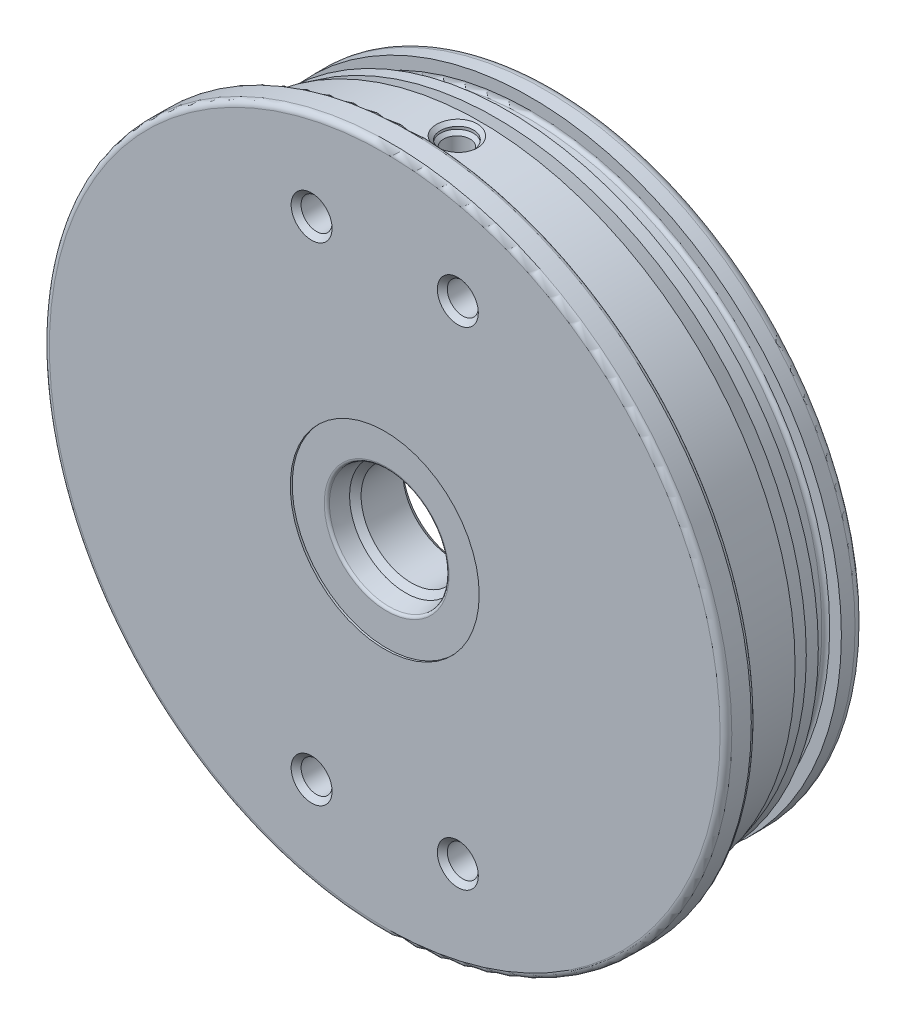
SolidWorks part; units mm, degrees
ref_plane "Front Plane" through (0, 0, 0) normal (0, 0, 1) x (1, 0, 0)
ref_plane "Top Plane" through (0, 0, 0) normal (0, 1, 0) x (1, 0, 0)
ref_plane "Right Plane" through (0, 0, 0) normal (1, 0, 0) x (0, 0, -1)
sketch "Sketch1" plane through (0, 0, 0) normal (1, 0, 0) x (0, 0, -1)
  line L0 (0, 0) -> (-31.3505, 0) construction
  line L1 (0, 0) -> (0, 39.1668)
  line L2 (-1.27, 40.4368) -> (-3.048, 40.4368)
  line L3 (-3.048, 40.4368) -> (-3.048, 38.9128)
  line L4 (-3.556, 38.4048) -> (-5.5471, 38.4048)
  line L5 (-6.0551, 38.9128) -> (-6.0551, 40.4368)
  line L6 (-6.0551, 40.4368) -> (-7.62, 40.4368)
  line L11 (-7.62, 40.4368) -> (-9.6107, 40.9702)
  line L12 (-9.6107, 40.9702) -> (-17.526, 40.9702)
  line L13 (-18.288, 41.7322) -> (-18.288, 44.45)
  line L14 (-18.288, 44.45) -> (-22.098, 44.45)
  line L15 (-22.098, 44.45) -> (-22.098, 0)
  line L16 (0, 0) -> (-22.098, 0)
  line L17 (-17.399, 41.1226) -> (-9.7523, 41.1226) construction
  arc A0 (-17.526, 40.9702) -> (-18.288, 41.7322) centre (-17.526, 41.7322) cw
  arc A1 (-3.048, 38.9128) -> (-3.556, 38.4048) centre (-3.556, 38.9128) cw
  arc A2 (-5.5471, 38.4048) -> (-6.0551, 38.9128) centre (-5.5471, 38.9128) cw
  arc A5 (0, 39.1668) -> (-1.27, 40.4368) centre (-1.27, 39.1668) ccw
  point P32 (-18.288, 40.9702)
  point P35 (-3.048, 38.4048)
  point P38 (-6.0551, 38.4048)
  dimension "D13" = 0.762
  dimension "D14" = 0.508
  dimension "D15" = 1.27
  dimension "D1" = 80.8736
  dimension "D2" = 76.8096
  dimension "D3" = 3.0071
  dimension "D4" = 3.048
  dimension "D5" = 1.5649
  dimension "D6" = 18.288
  dimension "D7" = 15
  dimension "D8" = 10.668
  dimension "D9" = 81.9404
  dimension "D10" = 8.6773
  dimension "D11" = 3.81
  dimension "D12" = 88.9
  dimension "D16" = 1.778
  dimension "D17" = 0.1524
revolve "Revolve1" add sketch "Sketch1" angle 360 about L0
fillet "Fillet1" radius 0.508 1 edges at (-44.45, 0, 18.288)
ref_plane "Plane1" through (0, 40.9702, 0) normal (0, 1, 0) x (1, 0, 0)
hole_wizard "#8-32 Tapped Hole1" positions "Sketch2" profile "Sketch3" tap size "#8-32" standard "ANSI Inch"
sketch "Sketch2" plane through (0, 40.9702, 0) normal (0, 1, 0) x (1, 0, 0)
  point P0 (0, -12.7)
sketch "Sketch3" plane through (0, 40.9702, 12.7) normal (1, 0, 0) x (0, 0, 1)
  line L0 (0, 0) -> (0, 11.1978)
  line L1 (0, 11.1978) -> (1.7272, 10.16)
  line L2 (1.7272, 10.16) -> (1.7272, 0.4318)
  line L3 (1.7272, 0.4318) -> (2.159, 0)
  line L5 (2.159, 0) -> (0, 0)
  line L6 (-1.7272, 0.4318) -> (-2.159, 0) construction
  line L10 (0, 11.1978) -> (-1.7272, 10.16) construction
  line L11 (0, -6.35) -> (0, 107.95) construction
  dimension "Tap Drill Dia." = 3.4544
  dimension "Tap Drill Depth" = 10.16
  dimension "Near C'Sink Dia." = 4.318
  dimension "Near C'Sink Angle" = 90
  dimension "Drill Angle" = 118
sketch "Sketch4" plane through (0, 40.9702, 0) normal (0, 1, 0) x (1, 0, 0)
  circle A0 centre (0, -12.7) radius 2.159
  dimension "D1" = 4.318
extrude "Cut-Extrude1" cut sketch "Sketch4" against normal blind 0.762
chamfer "Chamfer2" distance 0.508 angle 45 1 edges at (0, 40.2082, 14.4272)
chamfer "Chamfer1" distance 0.508 angle 45 1 edges at (-0.4932, 40.9672, 10.5981)
pattern_circular "CirPattern1" count 2 over 360 about axis through (0, 0, 0) along (0, 0, -1) of "Cut-Extrude1", "#8-32 Tapped Hole1", "Chamfer2", "Chamfer1"
sketch "Sketch6" plane through (0, 40.9702, 0) normal (0, 1, 0) x (1, 0, 0)
  circle A0 centre (0, -12.7) radius 3.429
  dimension "D1" = 6.858
sketch "Sketch7" plane through (0, 0, 0) normal (1, 0, 0) x (0, 0, -1)
  line L0 (0, 0) -> (-37.4487, 0) construction
  line L1 (-17.78, 0) -> (-17.78, 2.3595)
  line L2 (-14.0603, 11.3397) -> (0, 25.4)
  line L3 (0, -39.1668) -> (0, 39.1668) construction
  line L4 (0, 25.4) -> (0, 0)
  line L7 (0, 0) -> (-17.78, 0)
  line L8 (-22.098, 44.45) -> (-22.098, -44.45) construction
  arc A0 (-17.78, 2.3595) -> (-14.0603, 11.3397) centre (-5.08, 2.3595) cw
  dimension "D4" = 12.7
  dimension "D1" = 50.8
  dimension "D2" = 4.318
  dimension "D3" = 45
  dimension "D5" = 22.6795
revolve "Cut-Revolve1" cut sketch "Sketch7" angle 360 about L0
sketch "Sketch8" plane through (0, 0, 22.098) normal (0, 0, 1) x (1, 0, 0)
  line L0 (0, 23.9836) -> (0, 0) construction
  line L1 (0, 0) -> (30.48, 0) construction
  circle A0 centre (30.48, 0) radius 11.43
  circle A1 centre (-30.48, 0) radius 11.43
  circle A2 centre (0, 0) radius 30.48 construction
  dimension "D1" = 22.86
  dimension "D2" = 60.96
  dimension "D3" = 0
  dimension "D4" = 90
extrude "Cut-Extrude3" [suppressed] cut sketch "Sketch8" against normal blind 0.254
hole_wizard "7/16-20 Tapped Hole1" positions "Sketch9" profile "Sketch10" tap size "7/16-20" standard "ANSI Inch"
sketch "Sketch9" [suppressed] plane through (0, 0, 24.384) normal (0, 0, 1) x (1, 0, 0)
  point P0 (-30.48, 0)
  point P3 (30.48, 0)
sketch "Sketch10" plane through (-30.48, 0, 24.384) normal (1, 0, 0) x (0, -1, 0)
  line L0 (0, 0) -> (0, 25.8406)
  line L1 (0, 25.8406) -> (4.9606, 22.86)
  line L2 (4.9606, 22.86) -> (4.9606, 0)
  line L5 (4.9606, 0) -> (0, 0)
  line L10 (0, 25.8406) -> (-4.9606, 22.86) construction
  line L11 (0, -6.35) -> (0, 107.95) construction
  dimension "Tap Drill Dia." = 9.9212
  dimension "Tap Drill Depth" = 22.86
  dimension "Drill Angle" = 118
fillet "Fillet2" radius 0.762 1 edges at (-44.45, 0, 22.098)
sketch "Sketch11" plane through (0, 0, 0) normal (0, 0, -1) x (-1, 0, 0)
  circle A0 centre (0, 0) radius 36.195
  dimension "D1" = 72.39
extrude "Cut-Extrude4" cut sketch "Sketch11" against normal blind 5.588 draft 17.5
sketch "Sketch12" plane through (0, 0, 5.588) normal (0, 0, -1) x (-1, 0, 0)
  line L0 (-25.5413, 25.5413) -> (-27.1563, 27.1563) construction
  line L1 (0, 0) -> (-21.59, 21.59) construction
  line L2 (0, 0) -> (0, 29.3965) construction
  circle A0 centre (0, 0) radius 25.4
  circle A1 centre (-21.59, 21.59) radius 5.588 construction
  circle A3 centre (0, 0) radius 38.4048 construction
  circle A4 centre (0, 0) radius 38.4048 construction
  dimension "D1" = 50.8
  dimension "D2" = 11.176
  dimension "D3" = 2.2839
  dimension "D4" = 43.18
  dimension "D5" = 45
extrude "Cut-Extrude5" cut sketch "Sketch12" against normal up to surface (12.192 mm away)
fillet "Fillet3" [suppressed] radius 3.81
chamfer "Chamfer3" distance 0.762 angle 45 1 edges at (-36.195, 0, 0)
fillet "Fillet4" radius 2.54 1 edges at (25.4, 0, 17.78)
fillet "Fillet5" [suppressed] radius 0.762
sketch "Sketch13" [suppressed] plane through (0, 0, 24.638) normal (0, 0, 1) x (1, 0, 0)
  line L0 (0, 0) -> (58.3444, 0) construction
  line L1 (0, 0) -> (19.7935, 19.7935) construction
  circle A0 centre (0, 0) radius 11.43
  dimension "D1" = 22.86
  dimension "D2" = 45
extrude "Cut-Extrude6" [suppressed] cut sketch "Sketch13" against normal blind 0.254
sketch "Sketch14" [suppressed] plane through (0, 0, 28.448) normal (0, 0, 1) x (1, 0, 0)
  circle A0 centre (0, 0) radius 5.715
  dimension "D1" = 11.43
extrude "Cut-Extrude7" [suppressed] cut sketch "Sketch14" against normal through all
chamfer "Chamfer4" [suppressed] distance 0.254 angle 45
sketch "Sketch15" plane through (0, 0, 5.588) normal (0, 0, -1) x (-1, 0, 0)
  line L0 (0, 0) -> (0, 53.8221) construction
  line L1 (0, 0) -> (-14.2875, 26.2029) construction
  line L2 (-9.8486, 25.0638) -> (-11.0816, 29.4776) construction
  line L3 (-11.0816, 29.4776) -> (-15.5205, 30.6166) construction
  line L4 (-15.5205, 30.6166) -> (-18.7264, 27.342) construction
  line L5 (-18.7264, 27.342) -> (-17.4934, 22.9282) construction
  line L6 (-17.4934, 22.9282) -> (-13.0545, 21.7892) construction
  line L7 (-13.0545, 21.7892) -> (-9.8486, 25.0638) construction
  circle A0 centre (-14.2875, 26.2029) radius 4.7625
  circle A1 centre (-14.2875, 26.2029) radius 3.9688 construction
  circle A2 centre (0, 0) radius 29.845 construction
  circle A3 centre (-14.2875, 26.2029) radius 2.159 construction
  circle A4 centre (14.2875, 26.2029) radius 4.7625
  dimension "D1" = 9.525
  dimension "D2" = 7.9375
  dimension "D4" = 59.69
  dimension "D6" = 4.318
  dimension "D3" = 28.575
  dimension "D5" = 28.602
extrude "Cut-Extrude8" [suppressed] cut sketch "Sketch15" along normal through all
hole_wizard "#8-32 Tapped Hole2" positions "Sketch16" profile "Sketch17" tap size "#8-32" standard "ANSI Inch"
sketch "Sketch16" [suppressed] plane through (0, 0, 7.112) normal (0, 0, -1) x (-1, 0, 0)
  arc A0 (18.8434, 24.8155) -> (10.6535, 29.2811) centre (14.2875, 26.2029) ccw construction
  arc A1 (-10.6535, 29.2811) -> (-18.8434, 24.8155) centre (-14.2875, 26.2029) ccw construction
  point P9 (14.2875, 26.2029)
  point P11 (-14.2875, 26.2029)
sketch "Sketch17" plane through (-14.2875, 26.2029, 7.112) normal (1, 0, 0) x (0, 1, 0)
  line L0 (0, 0) -> (0, 11.176)
  line L1 (0, 11.176) -> (1.7272, 10.1382)
  line L2 (1.7272, 10.1382) -> (1.7272, 0.5588)
  line L3 (1.7272, 0.5588) -> (2.286, 0)
  line L5 (2.286, 0) -> (0, 0)
  line L6 (-1.7272, 0.5588) -> (-2.286, 0) construction
  line L10 (0, 11.176) -> (-1.7272, 10.1382) construction
  line L11 (0, -6.35) -> (0, 107.95) construction
  dimension "Tap Drill Dia." = 3.4544
  dimension "Tap Drill Depth" = 11.176
  dimension "Near C'Sink Dia." = 4.572
  dimension "Near C'Sink Angle" = 90
  dimension "Drill Angle" = 118
hole_wizard "#10-32 Tapped Hole1" positions "Sketch18" profile "Sketch19" tap size "#10-32" standard "ANSI Inch"
sketch "Sketch18" plane through (0, 0, 22.098) normal (0, 0, 1) x (1, 0, 0)
  line L0 (0, 0) -> (0, -92.6816) construction
  line L2 (0, 0) -> (-77.9465, 0) construction
  point P0 (9.525, -31.75)
  point P2 (-9.525, -31.75)
  point P16 (-9.525, 31.75)
  point P17 (9.525, 31.75)
  dimension "D1" = 31.75
  dimension "D2" = 19.05
sketch "Sketch19" plane through (9.525, -31.75, 22.098) normal (1, 0, 0) x (0, -1, 0)
  line L0 (0, 0) -> (0, 11.938)
  line L1 (0, 11.938) -> (2.0193, 10.7247)
  line L2 (2.0193, 10.7247) -> (2.0193, 0.6477)
  line L3 (2.0193, 0.6477) -> (2.667, 0)
  line L5 (2.667, 0) -> (0, 0)
  line L6 (-2.0193, 0.6477) -> (-2.667, 0) construction
  line L10 (0, 11.938) -> (-2.0193, 10.7247) construction
  line L11 (0, -6.35) -> (0, 107.95) construction
  dimension "Tap Drill Dia." = 4.0386
  dimension "Tap Drill Depth" = 11.938
  dimension "Near C'Sink Dia." = 5.334
  dimension "Near C'Sink Angle" = 90
  dimension "Drill Angle" = 118
hole_wizard "#12-28 Tapped Hole1" positions "Sketch20" profile "Sketch21" tap size "#12-28" standard "ANSI Inch"
sketch "Sketch20" plane through (0, 0, 24.638) normal (0, 0, 1) x (1, 0, 0)
  line L0 (0, -53.3847) -> (0, 0) construction
  line L1 (0, 0) -> (32.385, 0) construction
  circle A0 centre (0, 0) radius 32.385
  circle A1 centre (32.385, 0) radius 10.4775
  point P0 (32.385, 0)
  dimension "D1" = 64.77
  dimension "D3" = 20.955
  dimension "D2" = 90
sketch "Sketch21" plane through (32.385, 0, 24.638) normal (1, 0, 0) x (0, -1, 0)
  line L0 (0, 0) -> (0, 13.716)
  line L1 (0, 13.716) -> (2.3114, 12.3272)
  line L2 (2.3114, 12.3272) -> (2.3114, 0.7366)
  line L3 (2.3114, 0.7366) -> (3.048, 0)
  line L5 (3.048, 0) -> (0, 0)
  line L6 (-2.3114, 0.7366) -> (-3.048, 0) construction
  line L10 (0, 13.716) -> (-2.3114, 12.3272) construction
  line L11 (0, -6.35) -> (0, 107.95) construction
  dimension "Tap Drill Dia." = 4.6228
  dimension "Tap Drill Depth" = 13.716
  dimension "Near C'Sink Dia." = 6.096
  dimension "Near C'Sink Angle" = 90
  dimension "Drill Angle" = 118
sketch "Sketch22" [suppressed] plane through (0, 0, 24.638) normal (0, 0, 1) x (1, 0, 0)
  line L0 (0, -52.6535) -> (0, 0) construction
  line L1 (0, 0) -> (-55.5951, 0) construction
  line L2 (0, 0) -> (30.48, 0) construction
  line L3 (0, 0) -> (30.48, 0) construction
  circle A0 centre (-31.75, 0) radius 10.541
  circle A1 centre (0, 0) radius 31.75 construction
  dimension "D3" = 21.082
  dimension "D4" = 63.5
  dimension "D1" = 90
  dimension "D2" = 90
extrude "Cut-Extrude9" [suppressed] cut sketch "Sketch22" against normal blind 0.254
hole_wizard "7/16-20 Tapped Hole2" positions "Sketch23" profile "Sketch24" tap size "7/16-20" standard "ANSI Inch"
sketch "Sketch23" plane through (0, 0, 24.384) normal (0, 0, 1) x (1, 0, 0)
  point P0 (-31.75, 0)
sketch "Sketch24" plane through (-31.75, 0, 24.384) normal (1, 0, 0) x (0, -1, 0)
  line L0 (0, 0) -> (0, 13.97)
  line L1 (0, 13.97) -> (4.9606, 10.9894)
  line L2 (4.9606, 10.9894) -> (4.9606, 0)
  line L5 (4.9606, 0) -> (0, 0)
  line L10 (0, 13.97) -> (-4.9606, 10.9894) construction
  line L11 (0, -6.35) -> (0, 107.95) construction
  dimension "Tap Drill Dia." = 9.9212
  dimension "Tap Drill Depth" = 13.97
  dimension "Drill Angle" = 118
sketch "Sketch25" [suppressed] plane through (0, 0, 24.384) normal (0, 0, 1) x (1, 0, 0)
  circle A0 centre (-31.75, 0) radius 0.8001
  dimension "D1" = 1.6002
extrude "Cut-Extrude10" [suppressed] cut sketch "Sketch25" against normal through all
ref_plane "Plane2" [suppressed] through (0, 0, 0) normal (0, 1, 0) x (0, 0, 1)
sketch "Sketch26" [suppressed] plane through (0, 0, 0) normal (0, 1, 0) x (0, 0, 1)
  line L0 (12.446, -31.75) -> (20.232, -31.75) construction
  line L1 (7.9954, -31.75) -> (10.8947, -31.75) construction
  line L3 (13.3946, -31.75) -> (24.384, -31.75) construction
  line L4 (24.384, -25.5651) -> (22.0218, -26.0672)
  line L5 (24.384, -42.291) -> (24.384, -21.209) construction
  line L6 (22.0218, -26.0672) -> (16.339, -31.75)
  line L7 (16.339, -31.75) -> (24.384, -31.75)
  line L8 (24.384, -31.75) -> (24.384, -25.5651)
  dimension "D1" = 45
  dimension "D2" = 12
  dimension "D3" = 2.3622
  dimension "D4" = 12.3698
revolve "Cut-Revolve2" [suppressed] cut sketch "Sketch26" angle 360 about L0
fillet "Fillet6" [suppressed] radius 0.381
sketch "Sketch27" [suppressed] plane through (0, 0, 0) normal (0, 1, 0) x (1, 0, 0)
  line L0 (-30.48, -24.384) -> (-30.48, 0) construction
  line L1 (-41.91, -24.384) -> (-19.05, -24.384) construction
  line L2 (-36.0045, -24.384) -> (-36.0045, -5.2217)
  line L3 (-36.0045, -5.2217) -> (-35.433, -4.4601)
  line L4 (-38.3921, -5.8011) -> (38.3921, -5.8011) construction
  line L5 (-35.433, -4.4601) -> (-35.433, -1.5014)
  line L6 (-35.433, -1.5014) -> (-30.48, 0)
  line L7 (36.322, 0) -> (-36.322, 0) construction
  point P6 (-38.3667, -5.8011)
  dimension "D1" = 11.049
  dimension "D2" = 2.3622
  dimension "D3" = 9.906
  dimension "D4" = 2.9337
sketch "Sketch28" plane through (0, 0, 22.098) normal (0, 0, 1) x (1, 0, 0)
  line L0 (0, 0) -> (0, 16.1848) construction
  line L1 (0, 0) -> (60.1513, 0) construction
  circle A0 centre (-23.7934, 19.05) radius 9.4996
  circle A1 centre (-23.7934, 19.05) radius 5 construction
  circle A2 centre (23.7934, 19.05) radius 9.4996
  circle A3 centre (0, 0) radius 30.48 construction
  circle A4 centre (28.9535, -9.525) radius 9.4996
  circle A5 centre (-28.9535, -9.525) radius 9.4996
  dimension "D1" = 18.9992
  dimension "D2" = 47.5869
  dimension "D3" = 10
  dimension "D4" = 60.96
  dimension "D5" = 19.05
  dimension "D6" = 9.525
extrude "Cut-Extrude11" [suppressed] cut sketch "Sketch28" against normal blind 0.254
hole_wizard "M10x1.5 Tapped Hole1" positions "Sketch29" profile "Sketch30" tap size "M10x1.5" standard "ANSI Metric"
sketch "Sketch29" [suppressed] plane through (0, 0, 21.844) normal (0, 0, 1) x (1, 0, 0)
  point P0 (-23.7934, 19.05)
  point P3 (23.7934, 19.05)
  point P6 (-28.9535, -9.525)
  point P9 (28.9535, -9.525)
sketch "Sketch30" plane through (-23.7934, 19.05, 21.844) normal (1, 0, 0) x (0, -1, 0)
  line L0 (0, 0) -> (0, 21.844)
  line L1 (0, 21.844) -> (4.25, 21.844)
  line L2 (4.25, 21.844) -> (4.25, 0)
  line L5 (4.25, 0) -> (0, 0)
  line L11 (0, -6.35) -> (0, 107.95) construction
  dimension "Thru Tap Drill Dia." = 8.5
  dimension "Thru Tap Drill Depth" = 21.844
fillet "Fillet7" [suppressed] radius 0.762
sketch "Sketch32" plane through (0, 0, 5.588) normal (0, 0, -1) x (-1, 0, 0)
  line L0 (0, 0) -> (0, 53.8497) construction
  line L3 (-12.6735, 16.5164) -> (-18.7991, 24.4994)
  line L4 (0, 0) -> (65.2435, 0) construction
  line L5 (-8.4676, -19.0186) -> (-12.5604, -28.2111)
  line L6 (8.4676, -19.0186) -> (12.5604, -28.2111)
  line L7 (12.6735, 16.5164) -> (18.7991, 24.4994)
  arc A0 (-24.4938, 24.896) -> (-18.0052, -29.9261) centre (0, 0) ccw
  arc A3 (-12.6735, 16.5164) -> (-8.4676, -19.0186) centre (0, 0) ccw
  arc A7 (18.0052, -29.9261) -> (24.4938, 24.896) centre (0, 0) ccw
  arc A8 (8.4676, -19.0186) -> (12.6735, 16.5164) centre (0, 0) ccw
  arc A10 (-12.5604, -28.2111) -> (-18.0052, -29.9261) centre (-16.041, -26.6614) cw
  arc A11 (12.5604, -28.2111) -> (18.0052, -29.9261) centre (16.041, -26.6614) ccw
  arc A12 (18.7991, 24.4994) -> (24.4938, 24.896) centre (21.8217, 22.18) cw
  arc A17 (-18.7991, 24.4994) -> (-24.4938, 24.896) centre (-21.8217, 22.18) ccw
  point P25 (-14.2053, -31.9056)
  point P28 (14.2053, -31.9056)
  point P31 (21.261, 27.7079)
  point P46 (-21.261, 27.7079)
  dimension "D4" = 69.85
  dimension "D5" = 3.81
  dimension "D1" = 75
  dimension "D3" = 24
extrude "Cut-Extrude13" cut sketch "Sketch32" against normal blind 8.636 and the other way through all
fillet "Fillet9" radius 3.81 4 edges at (10.3311, -23.2041, 9.906) (-10.3311, -23.2041, 9.906) (-15.4625, 20.1512, 9.906) (15.4625, 20.1512, 9.906)
fillet "Fillet8" [suppressed] radius 2.54
sketch "Sketch31" [suppressed] plane through (0, 0, 0) normal (1, 0, 0) x (0, 0, -1)
  line L1 (33.9934, 61.2707) -> (-73.5827, 61.2707)
  line L2 (33.9934, 61.2707) -> (33.9934, -64.861)
  line L3 (33.9934, -64.861) -> (-73.5827, -64.861)
  line L4 (-73.5827, 61.2707) -> (-73.5827, -64.861)
  line L5 (33.9934, 61.2707) -> (-73.5827, -64.861) construction
  line L6 (33.9934, -64.861) -> (-73.5827, 61.2707) construction
  point P4 (-19.7946, -1.7951)
extrude "Cut-Extrude12" [suppressed] cut sketch "Sketch31" against normal through all
sketch "Sketch33" plane through (0, 0, 14.224) normal (0, 0, -1) x (-1, 0, 0)
  line L0 (0, 0) -> (0, 53.8497) construction
  line L1 (0, 0) -> (0, 53.8497) construction
  line L2 (-14.2053, 31.9056) -> (-3.2375, 7.2716)
  line L3 (-3.2375, 7.2716) -> (-34.6409, 4.4457)
  line L4 (3.2375, 7.2716) -> (34.6409, 4.4457)
  line L5 (14.2053, 31.9056) -> (3.2375, 7.2716)
  line L6 (-11.7793, -26.4567) -> (-12.5604, -28.2111) construction
  line L7 (-3.1522, -7.0799) -> (-20.7815, -46.6761) construction
  arc A0 (-24.4938, 24.896) -> (-18.0052, -29.9261) centre (0, 0) ccw construction
  arc A1 (-14.2053, 31.9056) -> (-34.6409, 4.4457) centre (0, 0) ccw
  arc A2 (14.2053, 31.9056) -> (34.6409, 4.4457) centre (0, 0) cw
  dimension "D1" = 24
  dimension "D2" = 24
extrude "Cut-Extrude14" cut sketch "Sketch33" along normal through all
sketch "Sketch34" [suppressed] plane through (0, 0, 7.112) normal (0, 0, -1) x (-1, 0, 0)
  circle A0 centre (-13.97, 27.8026) radius 2.286
  circle A1 centre (13.97, 27.8026) radius 2.286
  arc A5 (-11.9243, 26.7824) -> (-13.3593, 30.0055) centre (-13.97, 27.8026) ccw construction
  arc A6 (13.3593, 30.0055) -> (11.9243, 26.7824) centre (13.97, 27.8026) ccw construction
extrude "Boss-Extrude1" [suppressed] add sketch "Sketch34" against normal up to surface (14.986 mm away)
sketch "Sketch35" [suppressed] plane through (0, 0, 7.112) normal (0, 0, -1) x (-1, 0, 0)
  line L0 (-13.3593, 30.0055) -> (-11.9243, 26.7824)
  line L1 (13.3593, 30.0055) -> (11.9243, 26.7824)
  arc A0 (11.9243, 26.7824) -> (13.3593, 30.0055) centre (13.97, 27.8026) ccw construction
  arc A1 (-13.3593, 30.0055) -> (-11.9243, 26.7824) centre (-13.97, 27.8026) ccw construction
  arc A2 (11.9243, 26.7824) -> (13.3593, 30.0055) centre (13.97, 27.8026) ccw
  arc A3 (-13.3593, 30.0055) -> (-11.9243, 26.7824) centre (-13.97, 27.8026) ccw
extrude "Cut-Extrude15" [suppressed] cut sketch "Sketch35" against normal up to surface (7.112 mm away)
fillet "Fillet13" radius 3.81 2 edges at (10.3311, 23.2041, 9.906) (-10.3311, 23.2041, 9.906)
fillet "Fillet11" radius 3.81 2 edges at (-14.2053, 31.9056, 9.126) (14.2053, 31.9056, 9.126)
fillet "Fillet10" radius 2.54 14 edges at (-34.925, 0, 14.224) (34.925, 0, 14.224) (-9.8936, -24.5463, 14.224) (12.1698, -27.3339, 14.224) (14.8964, -30.2954, 14.224) (9.8936, -24.5463, 14.224) (12.1698, 27.3339, 14.224) (14.8964, 30.2954, 14.224) (-12.1698, -27.3339, 14.224) (-14.8964, -30.2954, 14.224) (-12.1698, 27.3339, 14.224) (-14.8964, 30.2954, 14.224) (-9.8936, 24.5463, 14.224) (9.8936, 24.5463, 14.224)
fillet "Fillet12" radius 1.6002 2 edges at (0, -34.4331, 5.588) (0, 34.4331, 5.588)
chamfer "Chamfer5" [suppressed] distance 3.81 angle 45
hole_wizard "#4-40 Tapped Hole1" positions "Sketch36" profile "Sketch37" tap size "#4-40" standard "ANSI Inch"
sketch "Sketch36" plane through (0, 0, 5.588) normal (0, 0, -1) x (-1, 0, 0)
  line L0 (0, 27.2663) -> (0, 0) construction
  line L1 (0, 0) -> (51.1985, 0) construction
  point P0 (-4.7625, 27.305)
  point P10 (4.7625, 27.305)
  point P11 (4.7625, -27.305)
  point P12 (-4.7625, -27.305)
  dimension "D1" = 9.525
  dimension "D2" = 54.61
sketch "Sketch37" plane through (4.7625, 27.305, 5.588) normal (1, 0, 0) x (0, 1, 0)
  line L0 (0, 0) -> (0, 8.2992)
  line L1 (0, 8.2992) -> (1.1303, 7.62)
  line L2 (1.1303, 7.62) -> (1.1303, 0.5207)
  line L3 (1.1303, 0.5207) -> (1.651, 0)
  line L5 (1.651, 0) -> (0, 0)
  line L6 (-1.1303, 0.5207) -> (-1.651, 0) construction
  line L10 (0, 8.2992) -> (-1.1303, 7.62) construction
  line L11 (0, -6.35) -> (0, 107.95) construction
  dimension "Tap Drill Dia." = 2.2606
  dimension "Tap Drill Depth" = 7.62
  dimension "Near C'Sink Dia." = 3.302
  dimension "Near C'Sink Angle" = 90
  dimension "Drill Angle" = 118
sketch "Sketch38" plane through (0, 0, 22.098) normal (0, 0, 1) x (1, 0, 0)
  circle A0 centre (0, 0) radius 12.3063
  dimension "D1" = 24.6126
extrude "Cut-Extrude16" cut sketch "Sketch38" against normal blind 0.254
sketch "Sketch41" plane through (0, 0, 17.78) normal (0, 0, -1) x (-1, 0, 0)
  circle A0 centre (0, 0) radius 11.43
  dimension "D1" = 22.86
extrude "Boss-Extrude2" add sketch "Sketch41" along normal blind 5.334 draft 20
hole_wizard "9/16-18 Tapped Hole1" positions "Sketch39" profile "Sketch40" tap size "9/16-18" standard "ANSI Inch"
sketch "Sketch39" plane through (0, 0, 21.844) normal (0, 0, 1) x (1, 0, 0)
  point P0 (0, 0)
sketch "Sketch40" plane through (0, 0, 21.844) normal (1, 0, 0) x (0, -1, 0)
  line L0 (0, 0) -> (0, 21.844)
  line L1 (0, 21.844) -> (6.5481, 21.844)
  line L2 (6.5481, 21.844) -> (6.5481, 0)
  line L5 (6.5481, 0) -> (0, 0)
  line L11 (0, -6.35) -> (0, 107.95) construction
  dimension "Thru Tap Drill Dia." = 13.0962
  dimension "Thru Tap Drill Depth" = 21.844
fillet "Fillet14" radius 2.54 1 edges at (11.43, 0, 17.78)
sketch "Sketch42" plane through (0, 0, 0) normal (1, 0, 0) x (0, 0, -1)
  line L0 (0, 0) -> (-49.8667, 0) construction
  line L1 (-21.844, 0) -> (-21.844, 7.8232)
  line L2 (-21.844, 7.8232) -> (-19.3802, 7.2995)
  line L3 (-19.3802, 7.2995) -> (-12.0807, 0)
  line L4 (-21.844, 12.3063) -> (-21.844, -12.3063) construction
  line L5 (-21.844, 0) -> (-12.0807, 0)
  dimension "D1" = 15.6464
  dimension "D2" = 12
  dimension "D3" = 2.4638
  dimension "D4" = 45
revolve "Cut-Revolve3" cut sketch "Sketch42" angle 360 about L0
fillet "Fillet15" radius 0.381 1 edges at (-7.8232, 0, 21.844)
chamfer "Chamfer6" distance 0.762 angle 45 1 edges at (-6.5481, 0, 12.446)
